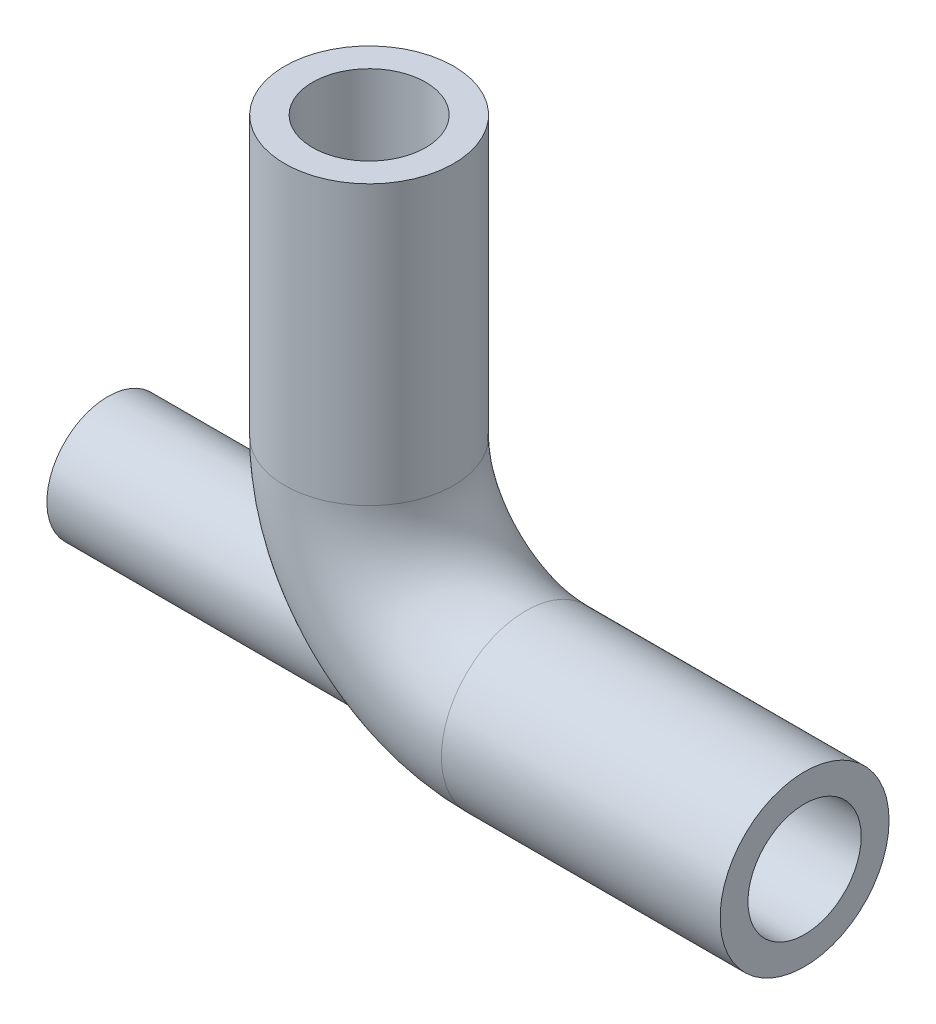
SolidWorks part; units mm, degrees
ref_plane "Front Plane" through (0, 0, 0) normal (0, 0, 1) x (1, 0, 0)
ref_plane "Top Plane" through (0, 0, 0) normal (0, 1, 0) x (1, 0, 0)
ref_plane "Right Plane" through (0, 0, 0) normal (1, 0, 0) x (0, 0, -1)
sketch "Sketch1" plane through (0, 0, 0) normal (0, 0, 1) x (1, 0, 0)
  line L0 (-90, 0) -> (-90, 160)
  line L1 (0, -90) -> (160, -90)
  arc A0 (-90, 0) -> (0, -90) centre (0, 0) ccw
  dimension "D1" = 90
  dimension "D2" = 250
  dimension "D3" = 250
ref_plane "Plane1" through (160, -90, 0) normal (1, 0, 0) x (0, 0, -1)
sketch "Sketch2" plane through (160, -90, 0) normal (1, 0, 0) x (0, 0, -1)
  circle A0 centre (0, 0) radius 48.5
  dimension "D1" = 97
sweep "Sweep-Thin1" add profiles "Sketch2" path "Sketch1" parameters "D1"=16
ref_plane "Plane2" through (-240, 0, 0) normal (1, 0, 0) x (0, 0, -1)
sketch "Sketch7" plane through (-240, 0, 0) normal (1, 0, 0) x (0, 0, -1)
  circle A0 centre (0, -90) radius 35
  circle A4 centre (0, -90) radius 48.5 construction
  dimension "D1" = 70
extrude "Boss-Extrude1" add sketch "Sketch7" along normal up to next
sketch "Sketch13" plane through (-240, 0, 0) normal (-1, 0, 0) x (0, 0, 1)
  circle A0 centre (0, -90) radius 30
  dimension "D1" = 60
extrude "Cut-Extrude2" cut sketch "Sketch13" against normal through all
